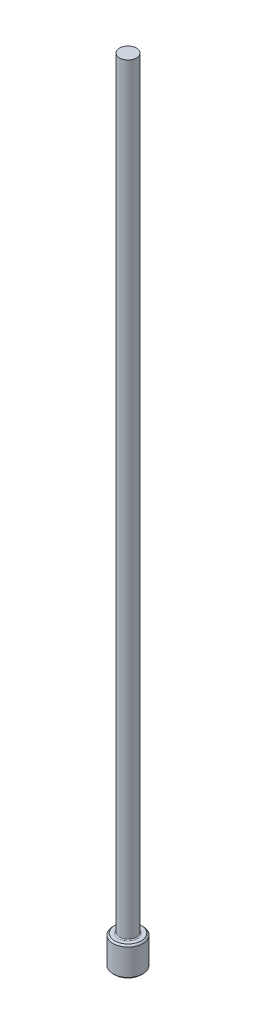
SolidWorks part; units mm, degrees
ref_plane "Front Plane" through (0, 0, 0) normal (0, 0, 1) x (1, 0, 0)
ref_plane "Top Plane" through (0, 0, 0) normal (0, 1, 0) x (1, 0, 0)
ref_plane "Right Plane" through (0, 0, 0) normal (1, 0, 0) x (0, 0, -1)
other "Configuration Table"
sketch "Sketch1" plane through (0, 0, 0) normal (0, 0, 1) x (1, 0, 0)
  line L0 (0, 259.9588) -> (0, -15.1925) construction
  line L1 (0, 0) -> (-1.1938, 0)
  line L2 (-1.1938, 0) -> (-1.1938, 2.3622)
  line L3 (-1.1938, 2.3622) -> (-0.6858, 2.3622)
  line L4 (-0.6858, 2.3622) -> (-0.6858, 63.5)
  line L5 (-0.6858, 63.5) -> (0, 63.5)
  line L6 (0, 63.5) -> (0, 0)
  dimension "L" = 63.5
  dimension "H" = 2.3876
  dimension "T" = 2.3622
  dimension "D" = 1.3716
revolve "Revolve1" add sketch "Sketch1" angle 360 about L0
chamfer "Chamfer1" distance 0.127 angle 45 2 edges at (0, 2.3622, 1.1938) (0, 0, 1.1938)
fillet "Fillet1" radius 0.0762 1 edges at (0, 2.3622, 0.6858)
